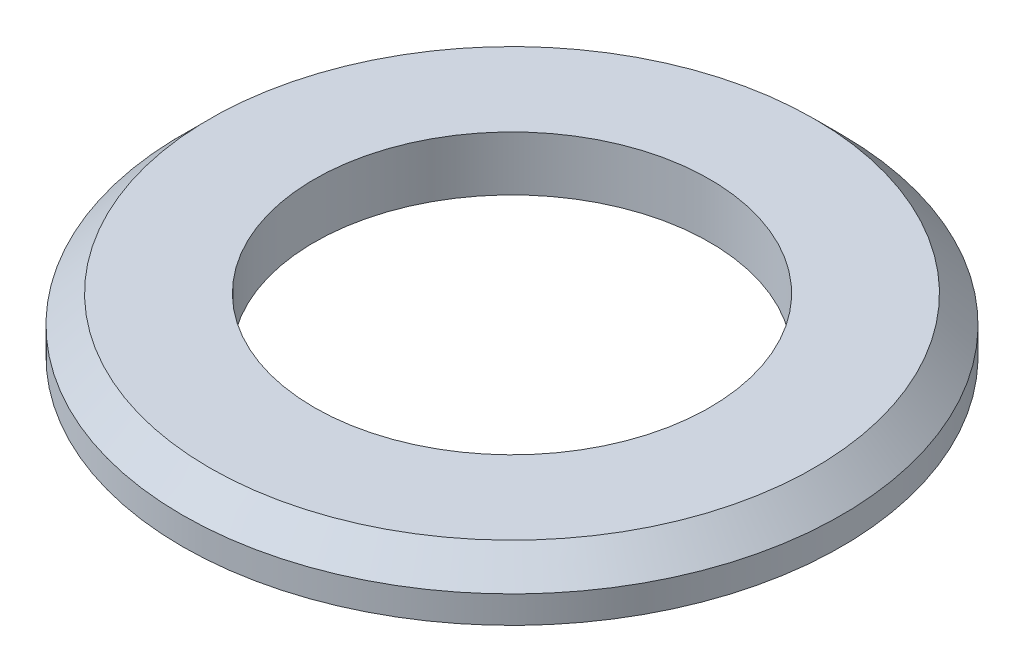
SolidWorks part; units mm, degrees
ref_plane "Front" through (0, 0, 0) normal (0, 0, 1) x (1, 0, 0)
ref_plane "Top" through (0, 0, 0) normal (0, 1, 0) x (1, 0, 0)
ref_plane "Right" through (0, 0, 0) normal (1, 0, 0) x (0, 0, -1)
sketch "Sketch1" plane through (0, 0, 0) normal (0, 1, 0) x (1, 0, 0)
  circle A0 centre (0, 0) radius 43.5
  circle A1 centre (0, 0) radius 72.5
extrude "Extrude1" add sketch "Sketch1" along normal blind 12
chamfer "Chamfer1" distance 6 1 edges at (0, 12, 72.5)
